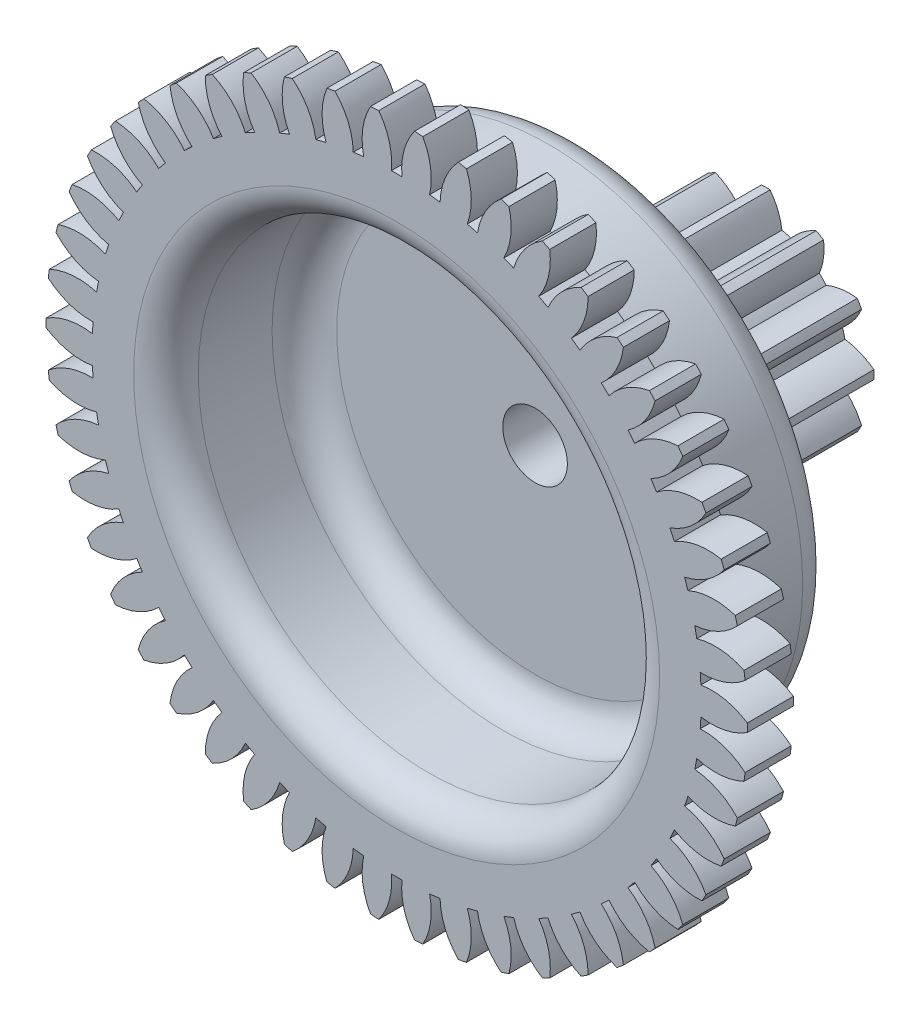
SolidWorks part; units mm, degrees
ref_plane "Front Plane" through (0, 0, 0) normal (0, 0, 1) x (1, 0, 0)
ref_plane "Top Plane" through (0, 0, 0) normal (0, 1, 0) x (1, 0, 0)
ref_plane "Right Plane" through (0, 0, 0) normal (1, 0, 0) x (0, 0, -1)
sketch "Sketch1" plane through (0, 0, 0) normal (0, 0, 1) x (1, 0, 0)
  circle A0 centre (0, 0) radius 6.6
  dimension "D1" = 13.2
extrude "Extrude1" add sketch "Sketch1" along normal mid plane 1
sketch "Sketch2" plane through (0, 0, 0.5) normal (0, 0, 1) x (1, 0, 0)
  line L0 (-7.6, 0) -> (-6.6, 0) construction
  arc A2 (-6.5932, 0.3) -> (-6.5932, -0.3) centre (0, 0) ccw
  arc A3 (-7.5995, -0.09) -> (-6.5932, -0.3) centre (-6.8237, 1.1113) ccw
  arc A4 (-7.5995, 0.09) -> (-7.5995, -0.09) centre (0, 0) ccw
  arc A5 (-6.5932, 0.3) -> (-7.5995, 0.09) centre (-6.8235, -1.1124) ccw
  circle A12 centre (0, 0) radius 6.6 construction
  point P7 (0, 0)
  dimension "D1" = 1
  dimension "D2" = 1.4311
  dimension "D3" = 1.43
  dimension "D4" = 0.18
  dimension "D5" = 0.6
extrude "Extrude2" add sketch "Sketch2" against normal blind 1
pattern_circular "CirPattern1" count 50 over 360 about axis through (0, 0, 0) along (0, 0, 1) of "Extrude2"
sketch "Sketch3" plane through (0, 0, -0.5) normal (0, 0, -1) x (-1, 0, 0)
  circle A1 centre (0, 0) radius 5.5
  dimension "D2" = 11
extrude "Extrude4" add sketch "Sketch3" along normal blind 3
sketch "Sketch4" plane through (0, 0, -3.5) normal (0, 0, -1) x (-1, 0, 0)
  line L0 (0, 2.3452) -> (0, 0) construction
  arc A0 (-0.35, 1.7146) -> (0.35, 1.7146) centre (0, 0) ccw
  arc A1 (0.0929, 2.3433) -> (-0.0929, 2.3433) centre (0, 0) ccw
  arc A2 (-0.0929, 2.3433) -> (-0.35, 1.7146) centre (0.9732, 1.5404) ccw
  arc A6 (0.35, 1.7146) -> (0.0929, 2.3433) centre (-0.9732, 1.5404) ccw
  dimension "D1" = 3.5
  dimension "D2" = 1.3346
  dimension "D3" = 0.1857
  dimension "D4" = 0.7
  dimension "D5" = 2.3452
extrude "Extrude3" add sketch "Sketch4" along normal blind 4
pattern_circular "CirPattern2" count 12 over 360 about axis through (0, 0, 0) along (0, 0, 1) of "Extrude3"
sketch "Sketch5" plane through (0, 0, -7.5) normal (0, 0, -1) x (-1, 0, 0)
  circle A0 centre (0, 0) radius 0.7
  dimension "D1" = 1.4
extrude "Cut-Extrude2" cut sketch "Sketch5" against normal up to surface (8 mm away)
sketch "Sketch6" plane through (0, 0, 0.5) normal (0, 0, 1) x (1, 0, 0)
  circle A0 centre (0, 0) radius 5
  circle A1 centre (0, 0) radius 0.7 construction
  circle A2 centre (0, 0) radius 0.7
  dimension "D1" = 10
extrude "Cut-Extrude4" cut sketch "Sketch6" against normal blind 3
fillet "Fillet1" radius 0.7 3 edges at (5, 0, 0.5) (-5.5, 0, -3.5) (5, 0, -2.5)
